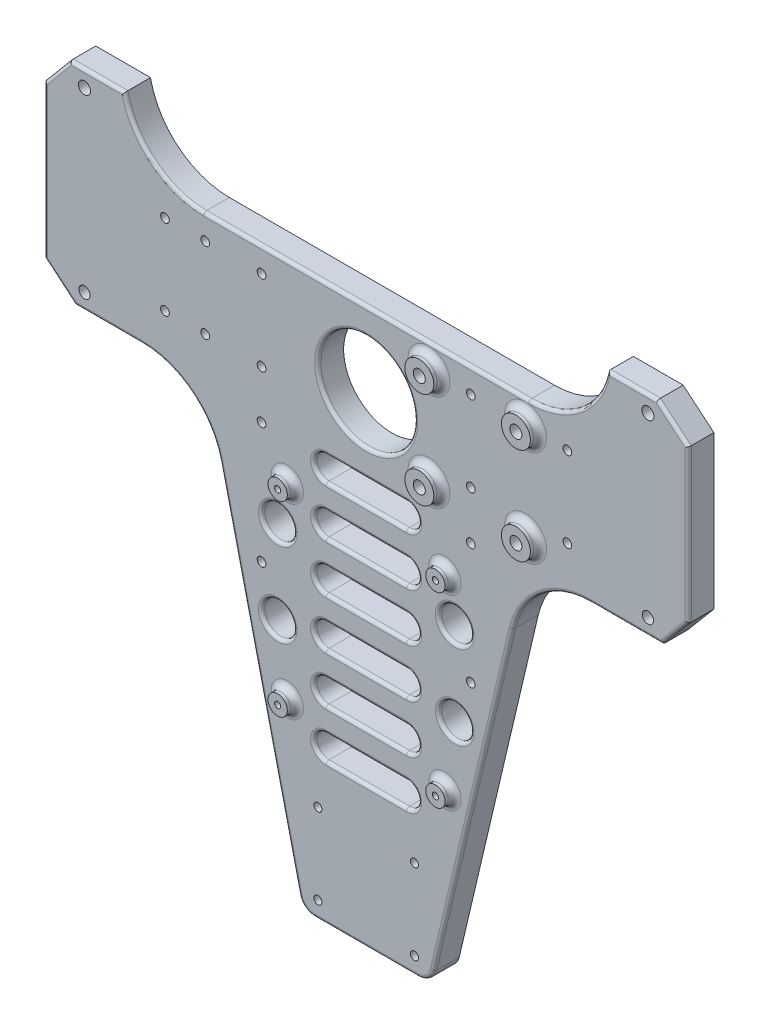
SolidWorks part; units mm, degrees
ref_plane "Front Plane" through (0, 0, 0) normal (0, 0, 1) x (1, 0, 0)
ref_plane "Top Plane" through (0, 0, 0) normal (0, 1, 0) x (1, 0, 0)
ref_plane "Right Plane" through (0, 0, 0) normal (1, 0, 0) x (0, 0, -1)
sketch "Sketch1" plane through (0, 0, 0) normal (0, 0, 1) x (1, 0, 0)
  line L0 (0, 0) -> (0, -160) construction
  line L1 (100, -32.5) -> (-100, -32.5)
  line L2 (100, -32.5) -> (100, 32.5)
  line L3 (100, 32.5) -> (-100, 32.5)
  line L4 (-100, -32.5) -> (-100, 32.5)
  line L5 (100, -32.5) -> (-100, 32.5) construction
  line L6 (100, 32.5) -> (-100, -32.5) construction
  line L7 (-20, -32.5) -> (20, -32.5)
  line L8 (-20, -32.5) -> (-20, -160)
  line L9 (-20, -160) -> (20, -160)
  line L10 (20, -32.5) -> (20, -160)
  line L11 (-50, -32.5) -> (-20, -160)
  line L12 (20, -160) -> (50, -32.5)
  line L14 (-75, 32.5) -> (75, 32.5)
  line L15 (-75, 32.5) -> (-75, 12.5)
  line L16 (-75, 12.5) -> (75, 12.5)
  line L17 (75, 32.5) -> (75, 12.5)
  point P0 (0, 0)
  dimension "D1" = 200
  dimension "D2" = 65
  dimension "D3" = 40
  dimension "D4" = 50
  dimension "D5" = 50
  dimension "D6" = 160
  dimension "D7" = 25
  dimension "D8" = 25
  dimension "D9" = 20
extrude "Boss-Extrude1" add sketch "Sketch1" along normal blind 8 contours L3 L17 L16 L15 L4 L1 L2 | L1 L11 L8 | L10 L12 L1 | L10 L1 L8 L9
sketch "Sketch2" plane through (0, 0, 8) normal (0, 0, 1) x (1, 0, 0)
  line L0 (-87.5, 27.5) -> (-87.5, -27.5) construction
  line L1 (-75, 12.5) -> (-100, 12.5) construction
  line L2 (-100, -32.5) -> (-100, 32.5) construction
  line L3 (-100, 32.5) -> (-100, -32.5) construction
  line L4 (-100, 0) -> (-87.5, 0) construction
  circle A0 centre (-87.5, 27.5) radius 1.875
  circle A1 centre (-87.5, -27.5) radius 1.75
  point P7 (-87.5, 12.5)
  dimension "D2" = 3.75
  dimension "D3" = 3.5
  dimension "D1" = 55
extrude "Cut-Extrude1" cut sketch "Sketch2" against normal through all
mirror "Mirror1" about plane through (0, 0, 0) normal (1, 0, 0) of "Cut-Extrude1"
fillet "Fillet1" radius 25 8 edges at (-75, 22.5, 0) (75, 22.5, 0) (-50, -32.5, 4) (-75, 12.5, 4) (75, 12.5, 4) (50, -32.5, 4) (75, 22.5, 8) (-75, 22.5, 8)
sketch "Sketch3" plane through (0, 0, 8) normal (0, 0, 1) x (1, 0, 0)
  line L0 (0, -47.5) -> (0, 12.5) construction
  line L1 (24.5, -105.5) -> (-24.5, -105.5)
  line L2 (24.5, -105.5) -> (24.5, -47.5)
  line L3 (24.5, -47.5) -> (-24.5, -47.5)
  line L4 (-24.5, -105.5) -> (-24.5, -47.5)
  line L5 (-50.5051, 12.5) -> (50.5051, 12.5) construction
  line L6 (34.5, -10) -> (0, -10) construction
  line L7 (19.5, 5) -> (49.5, 5)
  line L8 (19.5, 5) -> (19.5, -25)
  line L9 (19.5, -25) -> (49.5, -25)
  line L10 (49.5, 5) -> (49.5, -25)
  line L11 (19.5, 5) -> (49.5, -25) construction
  line L12 (19.5, -25) -> (49.5, 5) construction
  circle A0 centre (49.5, 5) radius 4.5
  circle A1 centre (19.5, 5) radius 4.5
  circle A2 centre (19.5, -25) radius 4.5
  circle A3 centre (49.5, -25) radius 4.5
  circle A4 centre (24.5, -47.5) radius 3
  circle A5 centre (-24.5, -47.5) radius 3
  circle A6 centre (-24.5, -105.5) radius 3
  circle A7 centre (24.5, -105.5) radius 3
  point P8 (34.5, -10)
  dimension "D8" = 9
  dimension "D9" = 6
  dimension "D1" = 49
  dimension "D2" = 58
  dimension "D3" = 30
  dimension "D4" = 30
  dimension "D5" = 7.5
  dimension "D6" = 60
  dimension "D7" = 34.5
extrude "Boss-Extrude2" add sketch "Sketch3" along normal blind 3 contours L2 A4 L3 | L3 A4 L2 | L3 A5 L4 | L4 A5 L3 | L4 A6 L1 | L1 A6 L4 | L1 A7 L2 | L2 A7 L1 | L10 A3 L9 | L9 A3 L10 | L8 A2 L9 | L9 A2 L8 | L7 A1 L8 | L8 A1 L7 | L10 A0 L7 | L7 A0 L10
sketch "Sketch4" plane through (0, 0, 11) normal (0, 0, 1) x (1, 0, 0)
  circle A0 centre (19.5, 5) radius 4.5 construction
  circle A1 centre (19.5, -25) radius 4.5 construction
  circle A2 centre (49.5, -25) radius 4.5 construction
  circle A3 centre (49.5, 5) radius 4.5 construction
  circle A4 centre (19.5, 5) radius 4.5
  circle A5 centre (19.5, -25) radius 4.5
  circle A6 centre (49.5, -25) radius 4.5
  circle A7 centre (49.5, 5) radius 4.5
  circle A8 centre (19.5, 5) radius 1.875
  circle A9 centre (49.5, 5) radius 1.875
  circle A10 centre (49.5, -25) radius 1.875
  circle A11 centre (19.5, -25) radius 1.875
  dimension "D1" = 3.75
extrude "Cut-Extrude2" cut sketch "Sketch4" against normal through all contours A8 | A9 | A10 | A11
sketch "Sketch5" plane through (0, 0, 11) normal (0, 0, 1) x (1, 0, 0)
  circle A0 centre (24.5, -47.5) radius 3 construction
  circle A1 centre (-24.5, -47.5) radius 3 construction
  circle A2 centre (-24.5, -105.5) radius 3 construction
  circle A3 centre (24.5, -105.5) radius 3 construction
  circle A4 centre (24.5, -47.5) radius 3
  circle A5 centre (-24.5, -47.5) radius 3
  circle A6 centre (-24.5, -105.5) radius 3
  circle A7 centre (24.5, -105.5) radius 3
  circle A8 centre (-24.5, -47.5) radius 0.95
  circle A9 centre (24.5, -47.5) radius 0.95
  circle A10 centre (24.5, -105.5) radius 0.95
  circle A11 centre (-24.5, -105.5) radius 0.95
  dimension "D1" = 1.9
extrude "Cut-Extrude3" cut sketch "Sketch5" against normal through all contours A8 | A9 | A10 | A11
chamfer "Chamfer1" distance 8 angle 50 4 edges at (-100, -32.5, 4) (-100, 32.5, 4) (100, 32.5, 4) (100, -32.5, 4)
sketch "Sketch6" plane through (0, 0, 8) normal (0, 0, 1) x (1, 0, 0)
  line L0 (12.5, -37.5) -> (-12.5, -37.5) construction
  line L1 (12.5, -41.25) -> (-12.5, -41.25)
  line L2 (12.5, -33.75) -> (-12.5, -33.75)
  line L3 (0, 12.5) -> (0, -160) construction
  line L4 (-50.5051, 12.5) -> (50.5051, 12.5) construction
  line L5 (-20, -160) -> (20, -160) construction
  arc A0 (12.5, -41.25) -> (12.5, -33.75) centre (12.5, -37.5) ccw
  arc A1 (-12.5, -33.75) -> (-12.5, -41.25) centre (-12.5, -37.5) ccw
  point P2 (0, -37.5)
  dimension "D1" = 25
  dimension "D2" = 7.5
  dimension "D3" = 50
extrude "Cut-Extrude4" cut sketch "Sketch6" against normal through all
pattern_linear "LPattern1" count 6 spacing 15 along (0, -1, 0) of "Cut-Extrude4"
sketch "Sketch7" plane through (0, 0, 8) normal (0, 0, 1) x (1, 0, 0)
  line L0 (-50.5051, 12.5) -> (50.5051, 12.5) construction
  line L1 (62.5, -20) -> (-62.5, -20)
  line L2 (62.5, -20) -> (62.5, 5)
  line L3 (62.5, 5) -> (-62.5, 5)
  line L4 (-62.5, -20) -> (-62.5, 5)
  line L5 (62.5, -20) -> (-62.5, 5) construction
  line L6 (62.5, 5) -> (-62.5, -20) construction
  line L7 (32.5, -20) -> (-32.5, -20)
  line L8 (32.5, -20) -> (32.5, 5)
  line L9 (32.5, 5) -> (-32.5, 5)
  line L10 (-32.5, -20) -> (-32.5, 5)
  line L11 (32.5, -20) -> (-32.5, 5) construction
  line L12 (32.5, 5) -> (-32.5, -20) construction
  line L13 (50, -20) -> (-50, -20)
  line L14 (50, -20) -> (50, 5)
  line L15 (50, 5) -> (-50, 5)
  line L16 (-50, -20) -> (-50, 5)
  line L17 (50, -20) -> (-50, 5) construction
  line L18 (50, 5) -> (-50, -20) construction
  line L19 (32.5, -72.5) -> (-32.5, -72.5)
  line L20 (32.5, -72.5) -> (32.5, -20)
  line L21 (32.5, -20) -> (-32.5, -20)
  line L22 (-32.5, -72.5) -> (-32.5, -20)
  line L23 (32.5, -72.5) -> (-32.5, -20) construction
  line L24 (32.5, -20) -> (-32.5, -72.5) construction
  line L25 (-32.5, -20) -> (32.5, -20)
  line L26 (-32.5, -20) -> (-32.5, -35)
  line L27 (-32.5, -35) -> (32.5, -35)
  line L28 (32.5, -20) -> (32.5, -35)
  line L29 (0, -7.5) -> (0, 12.5) construction
  point P0 (0, -7.5)
  point P5 (0, -7.5)
  point P10 (0, -7.5)
  point P15 (0, -46.25)
  dimension "D1" = 65
  dimension "D2" = 85
  dimension "D3" = 25
  dimension "D4" = 7.5
  dimension "D5" = 12.5
  dimension "D6" = 30
  dimension "D7" = 15
hole_wizard "Ø2.7 (2.7) Diameter Hole1" positions "Sketch8" profile "Sketch9" hole size "Ø2.7" standard "DIN"
sketch "Sketch8" plane through (0, 0, 8) normal (0, 0, 1) x (1, 0, 0)
  point P0 (-62.5, 5)
  point P3 (-62.5, -20)
  point P6 (-50, -20)
  point P9 (-50, 5)
  point P12 (-32.5, 5)
  point P15 (-32.5, -20)
  point P18 (-32.5, -35)
  point P21 (-32.5, -72.5)
  point P24 (32.5, -72.5)
  point P27 (32.5, -35)
  point P33 (32.5, -20)
  point P36 (62.5, -20)
  point P39 (62.5, 5)
  point P44 (32.5, 5)
sketch "Sketch9" plane through (-62.5, 5, 8) normal (1, 0, 0) x (0, -1, 0)
  line L0 (0, 0) -> (0, 8)
  line L1 (0, 8) -> (1.35, 8)
  line L2 (1.35, 8) -> (1.35, 0)
  line L5 (1.35, 0) -> (0, 0)
  line L11 (0, -6.35) -> (0, 107.95) construction
  dimension "Thru Hole Dia." = 2.7
  dimension "Thru Hole Depth" = 8
sketch "Sketch10" plane through (0, 0, 8) normal (0, 0, 1) x (1, 0, 0)
  line L0 (0, 12.5) -> (0, -10.625) construction
  line L1 (-50.5051, 12.5) -> (50.5051, 12.5) construction
  line L2 (0, -10.625) -> (0, -33.75) construction
  line L3 (12.5, -33.75) -> (-12.5, -33.75) construction
  circle A0 centre (0, -10.625) radius 15
  dimension "D1" = 30
extrude "Cut-Extrude5" cut sketch "Sketch10" against normal through all
fillet "Fillet2" radius 5 2 edges at (20, -160, 4) (-20, -160, 4)
sketch "Sketch11" plane through (0, 0, 8) normal (0, 0, 1) x (1, 0, 0)
  line L0 (-33.85, -72.5) -> (33.85, -72.5) construction
  line L1 (27.5, -85.5) -> (-27.5, -85.5)
  line L2 (27.5, -85.5) -> (27.5, -59.5)
  line L3 (27.5, -59.5) -> (-27.5, -59.5)
  line L4 (-27.5, -85.5) -> (-27.5, -59.5)
  line L5 (27.5, -85.5) -> (-27.5, -59.5) construction
  line L6 (27.5, -59.5) -> (-27.5, -85.5) construction
  circle A0 centre (-32.5, -72.5) radius 1.35 construction
  circle A1 centre (32.5, -72.5) radius 1.35 construction
  circle A2 centre (-27.5, -59.5) radius 5
  circle A3 centre (-27.5, -85.5) radius 5
  circle A4 centre (27.5, -85.5) radius 5
  circle A5 centre (27.5, -59.5) radius 5
  point P0 (0, -72.5)
  dimension "D3" = 10
  dimension "D1" = 26
  dimension "D2" = 55
extrude "Cut-Extrude6" cut sketch "Sketch11" against normal through all contours L3 A2 L4 | L4 A2 L3 | L2 A5 L3 | L3 A5 L2 | L1 A4 L2 | L2 A4 L1 | L1 A3 L4 | L4 A3 L1
fillet "Fillet3" radius 1 49 edges at (-19.1443, -158.9196, 8) (-33.186, -103.9596, 8) (-54.2786, -37.9022, 8) (80.9002, -32.5, 8) (-95.233, -28.5, 8) (-100, -0.767, 8) (-96, 27.733, 8) (-83.5, 32.5, 8) (-66.3165, 18.1351, 8) (0, 12.5, 8) (66.3165, 18.1351, 8) (82.733, 32.5, 8) (95.233, 28.5, 8) (100, 0.767, 8) (96, -27.733, 8) (-80.1332, -32.5, 8) (54.2786, -37.9022, 8) (33.186, -103.9596, 8) (19.1443, -158.9196, 8) (0, -160, 8) (15, -10.625, 8) (0, -63.75, 8) (-16.25, -67.5, 8) (0, -71.25, 8) (16.25, -67.5, 8) (0, -48.75, 8) (-16.25, -52.5, 8) (0, -56.25, 8) (16.25, -52.5, 8) (0, -33.75, 8) (-16.25, -37.5, 8) (0, -41.25, 8) (16.25, -37.5, 8) (16.25, -82.5, 8) (0, -86.25, 8) (-16.25, -82.5, 8) (16.25, -97.5, 8) (0, -101.25, 8) (-16.25, -97.5, 8) (16.25, -112.5, 8) (0, -116.25, 8) (-16.25, -112.5, 8) (0, -78.75, 8) (0, -93.75, 8) (0, -108.75, 8) (-22.5, -85.5, 8) (-22.5, -59.5, 8) (32.5, -59.5, 8) (32.5, -85.5, 8)
fillet "Fillet4" radius 2 8 edges at (-21.5, -47.5, 8) (-21.5, -105.5, 8) (27.5, -105.5, 8) (27.5, -47.5, 8) (54, -25, 8) (24, -25, 8) (24, 5, 8) (54, 5, 8)
sketch "Sketch12" plane through (0, 0, 8) normal (0, 0, 1) x (1, 0, 0)
  line L0 (0, -116.25) -> (0, -142.25) construction
  line L1 (-12.5, -116.25) -> (12.5, -116.25) construction
  line L3 (15, -154.75) -> (-15, -154.75)
  line L4 (15, -154.75) -> (15, -129.75) construction
  line L5 (15, -129.75) -> (-15, -129.75)
  line L6 (-15, -154.75) -> (-15, -129.75) construction
  line L7 (15, -154.75) -> (-15, -129.75) construction
  line L8 (15, -129.75) -> (-15, -154.75) construction
  circle A0 centre (-15, -154.75) radius 1.25
  circle A1 centre (-15, -129.75) radius 1.25
  circle A2 centre (15, -129.75) radius 1.25
  circle A3 centre (15, -154.75) radius 1.25
  dimension "D4" = 2.5
  dimension "D1" = 30
  dimension "D2" = 25
  dimension "D3" = 26
extrude "Cut-Extrude7" cut sketch "Sketch12" against normal blind 10
